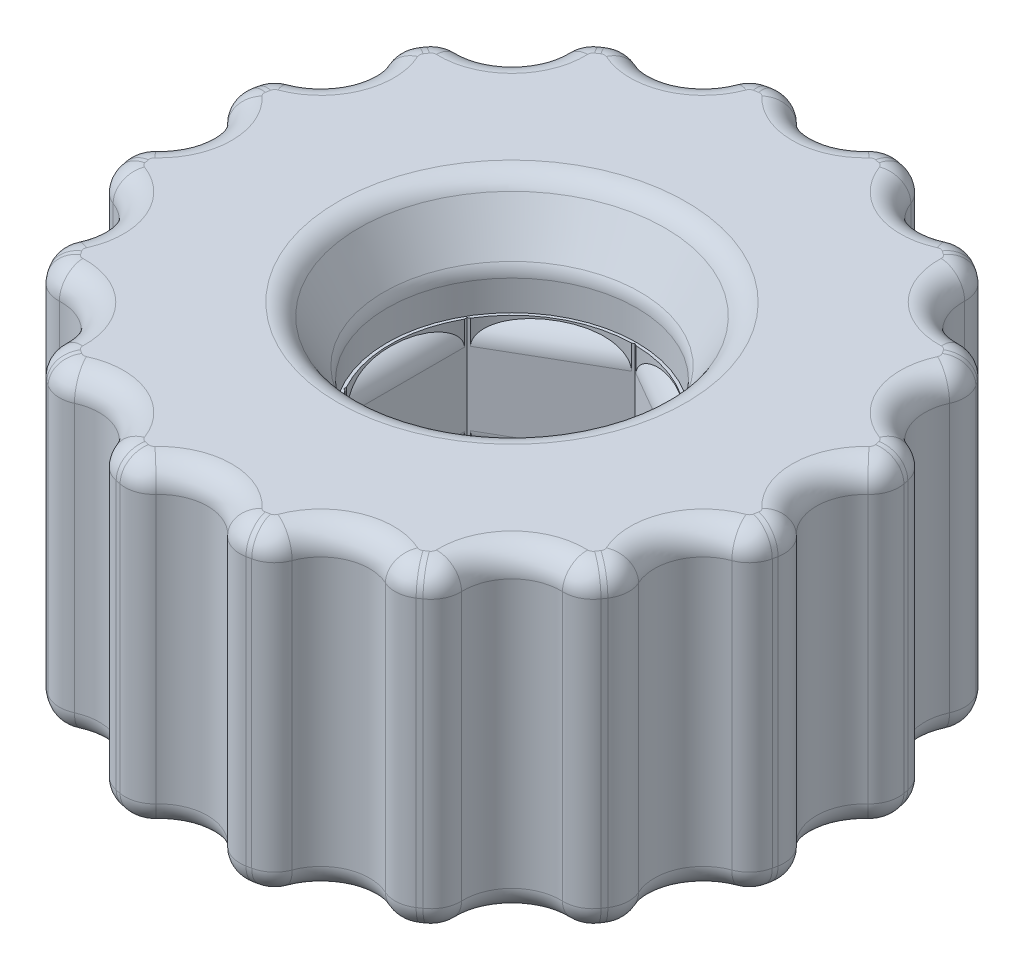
SolidWorks part; units mm, degrees
ref_plane "Спереди" through (0, 0, 0) normal (0, 0, 1) x (1, 0, 0)
ref_plane "Сверху" through (0, 0, 0) normal (0, 1, 0) x (1, 0, 0)
ref_plane "Справа" through (0, 0, 0) normal (1, 0, 0) x (0, 0, -1)
sketch "Эскиз1" plane through (0, 0, 0) normal (0, 1, 0) x (1, 0, 0)
  line L0 (0, 27.5) -> (0, 10.1036) construction
  line L1 (0, 10.1036) -> (-8.75, 5.0518)
  line L2 (-8.75, 5.0518) -> (-8.75, -5.0518)
  line L3 (-8.75, -5.0518) -> (0, -10.1036)
  line L4 (0, -10.1036) -> (8.75, -5.0518)
  line L5 (8.75, -5.0518) -> (8.75, 5.0518)
  line L6 (8.75, 5.0518) -> (0, 10.1036)
  circle A0 centre (0, 0) radius 27.5 construction
  circle A1 centre (0, 0) radius 8.75 construction
  arc A2 (2.9312, 26.2782) -> (-2.9312, 26.2782) centre (0, 29) cw
  arc A3 (5.1654, 27.0105) -> (5.5642, 26.9312) centre (0, 0) cw
  arc A4 (12.7643, 23.1562) -> (7.3482, 25.3996) centre (11.0978, 26.7925) cw
  arc A5 (15.1087, 22.9777) -> (15.4468, 22.7518) centre (0, 0) cw
  arc A6 (20.6542, 16.5088) -> (16.5088, 20.6542) centre (20.5061, 20.5061) cw
  arc A7 (22.7518, 15.4468) -> (22.9777, 15.1087) centre (0, 0) cw
  arc A8 (25.3996, 7.3482) -> (23.1562, 12.7643) centre (26.7925, 11.0978) cw
  arc A9 (26.9312, 5.5642) -> (27.0105, 5.1654) centre (0, 0) cw
  arc A10 (26.2782, -2.9312) -> (26.2782, 2.9312) centre (29, 0) cw
  arc A11 (27.0105, -5.1654) -> (26.9312, -5.5642) centre (0, 0) cw
  arc A12 (23.1562, -12.7643) -> (25.3996, -7.3482) centre (26.7925, -11.0978) cw
  arc A13 (22.9777, -15.1087) -> (22.7518, -15.4468) centre (0, 0) cw
  arc A14 (16.5088, -20.6542) -> (20.6542, -16.5088) centre (20.5061, -20.5061) cw
  arc A15 (15.4468, -22.7518) -> (15.1087, -22.9777) centre (0, 0) cw
  arc A16 (7.3482, -25.3996) -> (12.7643, -23.1562) centre (11.0978, -26.7925) cw
  arc A17 (5.5642, -26.9312) -> (5.1654, -27.0105) centre (0, 0) cw
  arc A18 (-2.9312, -26.2782) -> (2.9312, -26.2782) centre (0, -29) cw
  arc A19 (-5.1654, -27.0105) -> (-5.5642, -26.9312) centre (0, 0) cw
  arc A20 (-12.7643, -23.1562) -> (-7.3482, -25.3996) centre (-11.0978, -26.7925) cw
  arc A21 (-15.1087, -22.9777) -> (-15.4468, -22.7518) centre (0, 0) cw
  arc A22 (-20.6542, -16.5088) -> (-16.5088, -20.6542) centre (-20.5061, -20.5061) cw
  arc A23 (-22.7518, -15.4468) -> (-22.9777, -15.1087) centre (0, 0) cw
  arc A24 (-25.3996, -7.3482) -> (-23.1562, -12.7643) centre (-26.7925, -11.0978) cw
  arc A25 (-26.9312, -5.5642) -> (-27.0105, -5.1654) centre (0, 0) cw
  arc A26 (-26.2782, 2.9312) -> (-26.2782, -2.9312) centre (-29, 0) cw
  arc A27 (-27.0105, 5.1654) -> (-26.9312, 5.5642) centre (0, 0) cw
  arc A28 (-23.1562, 12.7643) -> (-25.3996, 7.3482) centre (-26.7925, 11.0978) cw
  arc A29 (-22.9777, 15.1087) -> (-22.7518, 15.4468) centre (0, 0) cw
  arc A30 (-16.5088, 20.6542) -> (-20.6542, 16.5088) centre (-20.5061, 20.5061) cw
  arc A31 (-15.4468, 22.7518) -> (-15.1087, 22.9777) centre (0, 0) cw
  arc A32 (-7.3482, 25.3996) -> (-12.7643, 23.1562) centre (-11.0978, 26.7925) cw
  arc A33 (-5.5642, 26.9312) -> (-5.1654, 27.0105) centre (0, 0) cw
  arc A34 (-2.9312, 26.2782) -> (-5.1654, 27.0105) centre (-4.7096, 24.6268) ccw
  arc A35 (-7.3482, 25.3996) -> (-5.5642, 26.9312) centre (-5.0732, 24.5545) cw
  arc A36 (-15.1087, 22.9777) -> (-12.7643, 23.1562) centre (-13.7754, 20.9499) cw
  arc A37 (-16.5088, 20.6542) -> (-15.4468, 22.7518) centre (-14.0836, 20.744) cw
  arc A38 (-22.7518, 15.4468) -> (-20.6542, 16.5088) centre (-20.744, 14.0836) cw
  arc A39 (-23.1562, 12.7643) -> (-22.9777, 15.1087) centre (-20.9499, 13.7754) cw
  arc A40 (-26.9312, 5.5642) -> (-25.3996, 7.3482) centre (-24.5545, 5.0732) cw
  arc A41 (-26.2782, 2.9312) -> (-27.0105, 5.1654) centre (-24.6268, 4.7096) cw
  arc A42 (-27.0105, -5.1654) -> (-26.2782, -2.9312) centre (-24.6268, -4.7096) cw
  arc A43 (-25.3996, -7.3482) -> (-26.9312, -5.5642) centre (-24.5545, -5.0732) cw
  arc A44 (-22.9777, -15.1087) -> (-23.1562, -12.7643) centre (-20.9499, -13.7754) cw
  arc A45 (-20.6542, -16.5088) -> (-22.7518, -15.4468) centre (-20.744, -14.0836) cw
  arc A46 (-15.4468, -22.7518) -> (-16.5088, -20.6542) centre (-14.0836, -20.744) cw
  arc A47 (-12.7643, -23.1562) -> (-15.1087, -22.9777) centre (-13.7754, -20.9499) cw
  arc A48 (-5.5642, -26.9312) -> (-7.3482, -25.3996) centre (-5.0732, -24.5545) cw
  arc A49 (-2.9312, -26.2782) -> (-5.1654, -27.0105) centre (-4.7096, -24.6268) cw
  arc A50 (5.1654, -27.0105) -> (2.9312, -26.2782) centre (4.7096, -24.6268) cw
  arc A51 (7.3482, -25.3996) -> (5.5642, -26.9312) centre (5.0732, -24.5545) cw
  arc A52 (15.1087, -22.9777) -> (12.7643, -23.1562) centre (13.7754, -20.9499) cw
  arc A53 (16.5088, -20.6542) -> (15.4468, -22.7518) centre (14.0836, -20.744) cw
  arc A54 (22.7518, -15.4468) -> (20.6542, -16.5088) centre (20.744, -14.0836) cw
  arc A55 (23.1562, -12.7643) -> (22.9777, -15.1087) centre (20.9499, -13.7754) cw
  arc A56 (26.9312, -5.5642) -> (25.3996, -7.3482) centre (24.5545, -5.0732) cw
  arc A57 (26.2782, -2.9312) -> (27.0105, -5.1654) centre (24.6268, -4.7096) cw
  arc A58 (27.0105, 5.1654) -> (26.2782, 2.9312) centre (24.6268, 4.7096) cw
  arc A59 (25.3996, 7.3482) -> (26.9312, 5.5642) centre (24.5545, 5.0732) cw
  arc A60 (22.9777, 15.1087) -> (23.1562, 12.7643) centre (20.9499, 13.7754) cw
  arc A61 (20.6542, 16.5088) -> (22.7518, 15.4468) centre (20.744, 14.0836) cw
  arc A62 (15.4468, 22.7518) -> (16.5088, 20.6542) centre (14.0836, 20.744) cw
  arc A63 (12.7643, 23.1562) -> (15.1087, 22.9777) centre (13.7754, 20.9499) cw
  arc A64 (7.3482, 25.3996) -> (5.5642, 26.9312) centre (5.0732, 24.5545) ccw
  arc A65 (2.9312, 26.2782) -> (5.1654, 27.0105) centre (4.7096, 24.6268) cw
  point P17 (0, 25)
  point P19 (-3.6031, 27.2629)
  point P79 (0, 0)
  point P127 (3.6031, 27.2629)
  dimension "D1" = 55
  dimension "D4" = 4
  dimension "D6" = 2.4269
  dimension "D2" = 17.5
  dimension "D3" = 1.5
  dimension "D5" = 16
extrude "Бобышка-Вытянуть1" add sketch "Эскиз1" along normal blind 13
sketch "Эскиз2" plane through (0, 13, 0) normal (0, 1, 0) x (1, 0, 0)
  circle A0 centre (0, 0) radius 10
  dimension "D1" = 20
extrude "Вырез-Вытянуть1" cut sketch "Эскиз2" against normal blind 8
fillet "Скругление1" radius 2 6 edges at (8.75, 5, 0) (-8.75, 5, 0) (-4.375, 5, 7.5777) (4.375, 5, 7.5777) (4.375, 5, -7.5777) (-4.375, 5, -7.5777)
sketch "Эскиз3" plane through (0, 13, 0) normal (0, 1, 0) x (1, 0, 0)
  circle A0 centre (0, 0) radius 10.25
  dimension "D1" = 20.5
extrude "Вырез-Вытянуть2" cut sketch "Эскиз3" against normal blind 8
chamfer "Фаска2" distance 5 angle 30 1 edges at (0, 13, 10.25)
fillet "Скругление2" radius 2 66 edges at (3.9537, 13, -26.933) (5.365, 13, -26.9716) (6.6541, 13, -26.3959) (9.5671, 13, -23.097) (13.9596, 13, -23.3698) (15.2782, 13, -22.8654) (16.2488, 13, -21.8402) (17.6777, 13, -17.6777) (21.8402, 13, -16.2488) (22.8654, 13, -15.2782) (23.3698, 13, -13.9596) (23.097, 13, -9.5671) (26.3959, 13, -6.6541) (26.9716, 13, -5.365) (26.933, 13, -3.9537) (25, 13, 0) (26.933, 13, 3.9537) (26.9716, 13, 5.365) (26.3959, 13, 6.6541) (23.097, 13, 9.5671) (23.3698, 13, 13.9596) (22.8654, 13, 15.2782) (21.8402, 13, 16.2488) (17.6777, 13, 17.6777) (16.2488, 13, 21.8402) (15.2782, 13, 22.8654) (13.9596, 13, 23.3698) (9.5671, 13, 23.097) (6.6541, 13, 26.3959) (5.365, 13, 26.9716) (3.9537, 13, 26.933) (0, 13, 25) (-3.9537, 13, 26.933) (-5.365, 13, 26.9716) (-6.6541, 13, 26.3959) (-9.5671, 13, 23.097) (-13.9596, 13, 23.3698) (-15.2782, 13, 22.8654) (-16.2488, 13, 21.8402) (-17.6777, 13, 17.6777) (-21.8402, 13, 16.2488) (-22.8654, 13, 15.2782) (-23.3698, 13, 13.9596) (-23.097, 13, 9.5671) (-26.3959, 13, 6.6541) (-26.9716, 13, 5.365) (-26.933, 13, 3.9537) (-25, 13, 0) (-26.933, 13, -3.9537) (-26.9716, 13, -5.365) (-26.3959, 13, -6.6541) (-23.097, 13, -9.5671) (-23.3698, 13, -13.9596) (-22.8654, 13, -15.2782) (-21.8402, 13, -16.2488) (-17.6777, 13, -17.6777) (-16.2488, 13, -21.8402) (-15.2782, 13, -22.8654) (-13.9596, 13, -23.3698) (-9.5671, 13, -23.097) (-6.6541, 13, -26.3959) (-5.365, 13, -26.9716) (-3.9537, 13, -26.933) (0, 13, -25) (0, 8, 10.25) (0, 13, 13.1368)
mirror "Зеркальное отражение1" about plane through (-2.3548, 0, -12.3134) normal (0, 1, 0)
